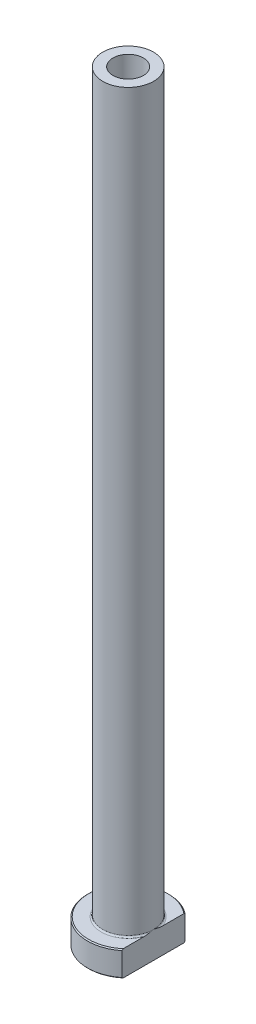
SolidWorks part; units mm, degrees
ref_plane "Front Plane" through (0, 0, 0) normal (0, 0, 1) x (1, 0, 0)
ref_plane "Top Plane" through (0, 0, 0) normal (0, 1, 0) x (1, 0, 0)
ref_plane "Right Plane" through (0, 0, 0) normal (1, 0, 0) x (0, 0, -1)
sketch "Sketch1" plane through (0, 0, 0) normal (0, 0, 1) x (1, 0, 0)
  line L0 (-3, 150) -> (-5, 150)
  line L1 (-5, 150) -> (-5, 5)
  line L2 (-5, 5) -> (-8, 5)
  line L3 (-8, 5) -> (-8, 0)
  line L4 (7.15, 0) -> (-7.15, 0) construction
  line L5 (-8, 0) -> (-3.25, 0)
  line L6 (-3, 105) -> (-3, 150)
  line L7 (0, 92.1877) -> (0, -15.5353) construction
  line L8 (0, -8.8) -> (0, 8.8) construction
  line L9 (-3, 105) -> (-3.25, 93)
  line L10 (-3.25, 93) -> (-3.25, 0)
  dimension "D1" = 0.25
  dimension "ID" = 6
  dimension "OD" = 10
  dimension "L" = 150
  dimension "H" = 16
  dimension "T" = 5
  dimension "N" = 45
  dimension "D2" = 12
  dimension "L-N" = 105
revolve "Revolve1" add sketch "Sketch1" angle 360 about L7
fillet "Fillet1" radius 0.3 1 edges at (0, 5, 5)
chamfer "Chamfer1" distance 0.2 angle 45 2 edges at (0, 5, 8) (0, 0, 8)
sketch "Sketch2" plane through (0, 0, 0) normal (0, -1, 0) x (1, 0, 0)
  line L0 (5, 6.245) -> (5, -6.245)
  circle A0 centre (0, 0) radius 8 construction
  arc A1 (5, 6.245) -> (5, -6.245) centre (0, 0) cw
  circle A2 centre (0, 0) radius 5 construction
extrude "Cut-Extrude1" cut sketch "Sketch2" against normal through all
chamfer "Chamfer2" distance 0.5 angle 45 1 edges at (0, 0, 3.25)
